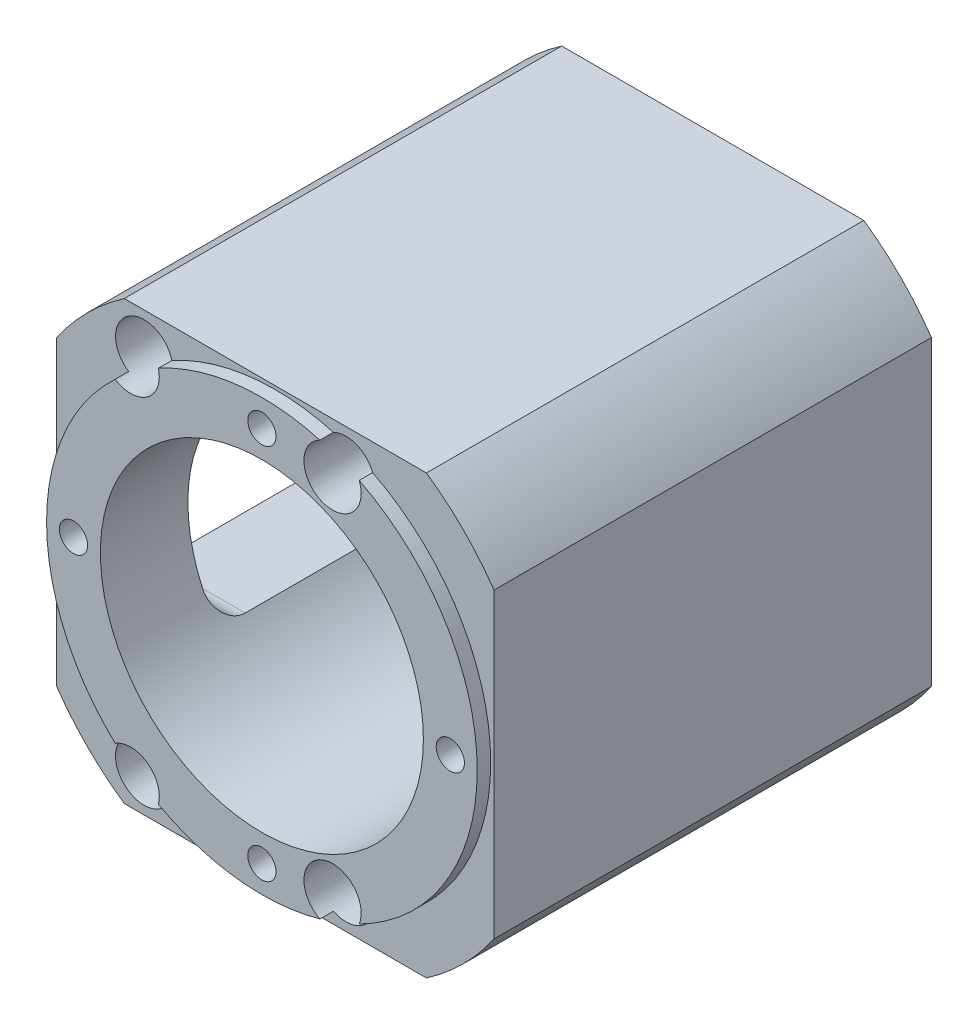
SolidWorks part; units mm, degrees
ref_plane "前视基准面" through (0, 0, 0) normal (0, 0, 1) x (1, 0, 0)
ref_plane "上视基准面" through (0, 0, 0) normal (0, 1, 0) x (1, 0, 0)
ref_plane "右视基准面" through (0, 0, 0) normal (1, 0, 0) x (0, 0, -1)
sketch "草图1" plane through (0, 0, 0) normal (0, 0, 1) x (1, 0, 0)
  line L1 (22.4499, 32.5) -> (-22.4499, 32.5)
  line L2 (32.5, 22.4499) -> (32.5, -22.4499)
  line L3 (22.4499, -32.5) -> (-22.4499, -32.5)
  line L4 (-32.5, 22.4499) -> (-32.5, -22.4499)
  line L5 (27.9307, 27.9307) -> (-27.9307, -27.9307) construction
  line L6 (27.9307, -27.9307) -> (-27.9307, 27.9307) construction
  arc A0 (-32.5, -22.4499) -> (-22.4499, -32.5) centre (0, 0) ccw
  circle A1 centre (0, 0) radius 24
  arc A2 (22.4499, -32.5) -> (32.5, -22.4499) centre (0, 0) ccw
  arc A3 (32.5, 22.4499) -> (22.4499, 32.5) centre (0, 0) ccw
  arc A4 (-22.4499, 32.5) -> (-32.5, 22.4499) centre (0, 0) ccw
  point P0 (0, 0)
  dimension "D2" = 79
  dimension "D3" = 48
  dimension "D5" = 32.5
  dimension "D6" = 32.5
  dimension "D1" = 65
  dimension "D4" = 65
extrude "凸台-拉伸1" add sketch "草图1" along normal blind 69
sketch "草图2" plane through (0, 0, 69) normal (0, 0, 1) x (1, 0, 0)
  circle A0 centre (0, 0) radius 32
  circle A1 centre (0, 0) radius 56.7752
  dimension "D1" = 64
extrude "切除-拉伸1" cut sketch "草图2" against normal blind 4
hole_wizard "M5 六角凹头螺钉的柱形沉头孔1" positions "草图5" profile "草图4" counterbore size "M5" standard "ISO"
sketch "草图5" plane through (0, 0, 69) normal (0, 0, 1) x (1, 0, 0)
  circle A0 centre (0, 0) radius 24 construction
  point P0 (10.5, -27)
  point P2 (10.5, 27)
  point P4 (-19.5, 27)
  point P6 (-19.5, -27)
  dimension "D1" = 19.5
  dimension "D2" = 10.5
  dimension "D3" = 27
  dimension "D4" = 27
  dimension "D5" = 27
sketch "草图4" plane through (10.5, -27, 69) normal (1, 0, 0) x (0, -1, 0)
  line L0 (0, 0) -> (0, 69)
  line L1 (0, 69) -> (2.65, 69)
  line L3 (2.65, 69) -> (2.65, 46)
  line L4 (2.65, 46) -> (4.25, 46)
  line L5 (4.25, 46) -> (4.25, 0)
  line L7 (4.25, 0) -> (0, 0)
  line L11 (0, -6.35) -> (0, 107.95) construction
  dimension "通孔孔直径" = 5.3
  dimension "通孔孔深度" = 69
  dimension "柱形沉头孔直径" = 8.5
  dimension "柱形沉头孔深度" = 46
hole_wizard "M5 螺纹孔1" positions "草图7" profile "草图6" tap size "M5" standard "ISO"
sketch "草图7" plane through (0, 0, 69) normal (0, 0, 1) x (1, 0, 0)
  circle A0 centre (0, 0) radius 28
  point P0 (0, 28)
  point P12 (28, 0)
  point P13 (0, -28)
  point P14 (-28, 0)
  point P15 (0, 0)
  dimension "D1" = 56
  dimension "D2" = 4
sketch "草图6" plane through (0, 28, 69) normal (1, 0, 0) x (0, -1, 0)
  line L0 (0, 0) -> (0, 21.2618)
  line L1 (0, 21.2618) -> (2.1, 20)
  line L2 (2.1, 20) -> (2.1, 0)
  line L5 (2.1, 0) -> (0, 0)
  line L10 (0, 21.2618) -> (-2.1, 20) construction
  line L11 (0, -6.35) -> (0, 107.95) construction
  dimension "螺纹孔钻头直径" = 4.2
  dimension "螺纹孔钻头深度" = 20
  dimension "导头角度" = 118
sketch "草图10" plane through (0, 0, 69) normal (0, 0, 1) x (1, 0, 0)
  circle A0 centre (0, 0) radius 74.3884
extrude "切除-拉伸5" cut sketch "草图10" against normal blind 2
hole_wizard "大小mm 暗销孔1" positions "草图14" profile "草图13" hole size "Ø4.0" standard "ISO"
sketch "草图14" plane through (0, 0, 0) normal (0, 0, -1) x (-1, 0, 0)
  line L0 (0, 24) -> (0, -24) construction
  circle A0 centre (0, 0) radius 24 construction
  point P0 (0, 28)
  point P2 (0, -28)
  dimension "D1" = 28
  dimension "D2" = 28
sketch "草图13" plane through (0, 28, 0) normal (1, 0, 0) x (0, 1, 0)
  line L0 (0, 0) -> (0, 13.2017)
  line L1 (0, 13.2017) -> (2, 12)
  line L2 (2, 12) -> (2, 0)
  line L5 (2, 0) -> (0, 0)
  line L10 (0, 13.2017) -> (-2, 12) construction
  line L11 (0, -6.35) -> (0, 107.95) construction
  dimension "孔直径" = 4
  dimension "孔深度" = 12
  dimension "导头角度" = 118
sketch "草图15" plane through (-32.5, 0, 0) normal (-1, 0, 0) x (0, 0, 1)
  line L0 (65, 0) -> (0, 0) construction
  line L1 (13, 14) -> (50, 14)
  line L2 (9, 10) -> (9, -10)
  line L3 (13, -14) -> (50, -14)
  line L4 (54, 10) -> (54, -10)
  line L5 (9, 14) -> (54, -14) construction
  line L6 (9, -14) -> (54, 14) construction
  line L7 (65, 22.4499) -> (65, -22.4499) construction
  line L8 (0, 22.4499) -> (0, -22.4499) construction
  line L9 (67, -23.4259) -> (67, 23.4259) construction
  arc A0 (50, 14) -> (54, 10) centre (50, 10) cw
  arc A1 (50, -14) -> (54, -10) centre (50, -10) ccw
  arc A2 (13, 14) -> (9, 10) centre (13, 10) ccw
  arc A3 (9, -10) -> (13, -14) centre (13, -10) ccw
  point P0 (31.5, 0)
  dimension "D4" = 4
  dimension "D1" = 13
  dimension "D2" = 45
  dimension "D3" = 28
extrude "切除-拉伸6" cut sketch "草图15" against normal blind 15
